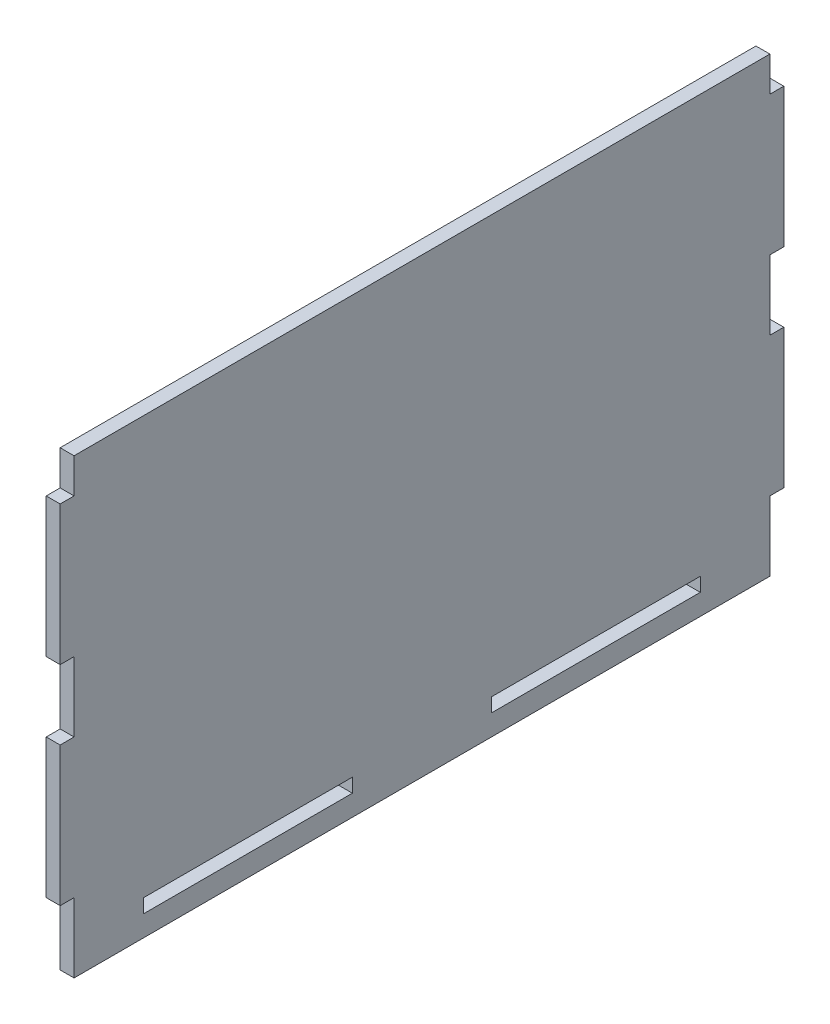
SolidWorks part; units mm, degrees
ref_plane "Alzado" through (0, 0, 0) normal (0, 0, 1) x (1, 0, 0)
ref_plane "Planta" through (0, 0, 0) normal (0, 1, 0) x (1, 0, 0)
ref_plane "Vista lateral" through (0, 0, 0) normal (1, 0, 0) x (0, 0, -1)
sketch "Croquis1" plane through (0, 0, 0) normal (1, 0, 0) x (0, 0, -1)
  line L0 (500, 0) -> (500, 14.1947) construction
  line L1 (0, 0) -> (1000, 0)
  line L2 (0, 0) -> (0, 100)
  line L3 (0, 650) -> (1000, 650)
  line L4 (1000, 0) -> (1000, 100)
  line L5 (0, 600) -> (-20, 600)
  line L7 (0, 400) -> (-20, 400)
  line L8 (-20, 600) -> (-20, 400)
  line L9 (0, 300) -> (-20, 300)
  line L11 (0, 100) -> (-20, 100)
  line L12 (-20, 300) -> (-20, 100)
  line L13 (100, 50) -> (400, 50)
  line L14 (100, 50) -> (100, 30)
  line L15 (100, 30) -> (400, 30)
  line L16 (400, 50) -> (400, 30)
  line L17 (600, 50) -> (900, 50)
  line L18 (600, 50) -> (600, 30)
  line L19 (600, 30) -> (900, 30)
  line L20 (900, 50) -> (900, 30)
  line L21 (1000, 100) -> (1020, 100)
  line L22 (1020, 300) -> (1020, 100)
  line L23 (1000, 300) -> (1020, 300)
  line L25 (1000, 400) -> (1020, 400)
  line L26 (1020, 600) -> (1020, 400)
  line L27 (1000, 600) -> (1020, 600)
  line L29 (0, 600) -> (0, 650)
  line L30 (0, 300) -> (0, 400)
  line L31 (1000, 600) -> (1000, 650)
  line L32 (1000, 300) -> (1000, 400)
  point P21 (-10, 100)
  dimension "D1" = 200
  dimension "D2" = 1000
  dimension "D3" = 300
  dimension "D4" = 20
  dimension "D5" = 650
  dimension "D6" = 50
  dimension "D7" = 50
  dimension "D8" = 50
  dimension "D9" = 100
  dimension "D10" = 100
extrude "Saliente-Extruir1" add sketch "Croquis1" along normal blind 20
